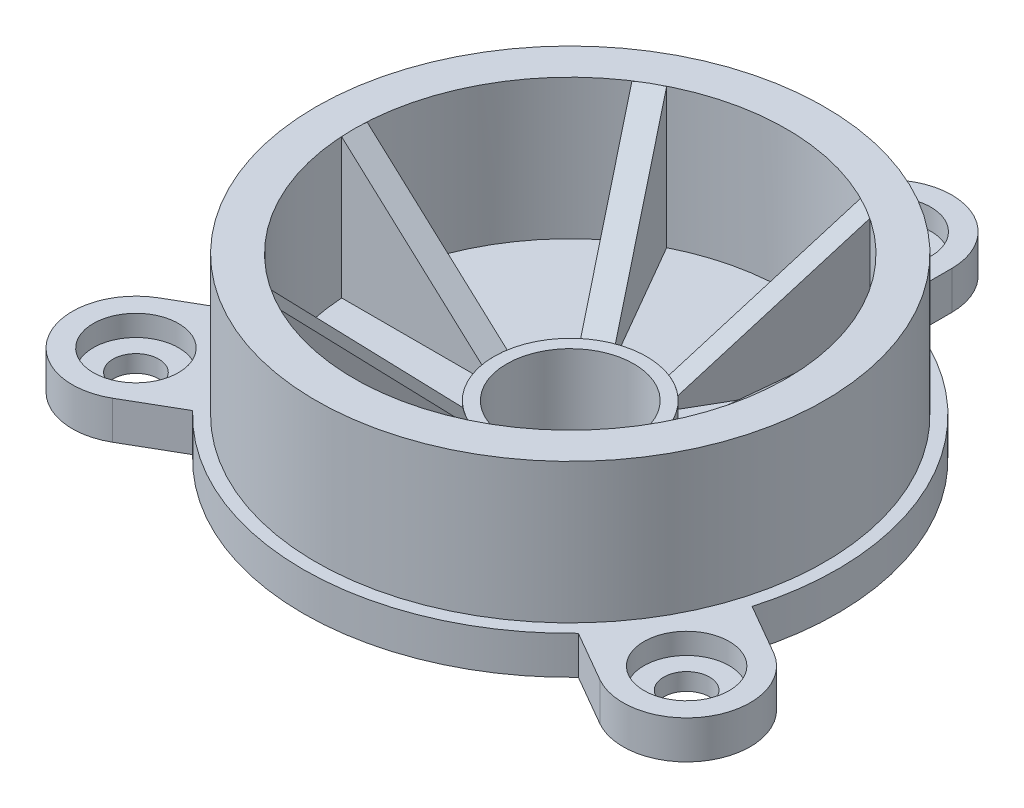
SolidWorks part; units mm, degrees
ref_plane "Front" through (0, 0, 0) normal (0, 0, 1) x (1, 0, 0)
ref_plane "Top" through (0, 0, 0) normal (0, 1, 0) x (1, 0, 0)
ref_plane "Right" through (0, 0, 0) normal (1, 0, 0) x (0, 0, -1)
sketch "Sketch1" plane through (0, 0, 0) normal (0, 0, 1) x (1, 0, 0)
  line L0 (0, 69.7565) -> (0, -46.2109) construction
  line L1 (17, 16) -> (20, 16)
  line L2 (20, 16) -> (20, 5)
  line L3 (20, 5) -> (21, 5)
  line L4 (21, 5) -> (21, 2)
  line L5 (21, 2) -> (10, 2)
  line L6 (10, 2) -> (10, 0)
  line L7 (10, 0) -> (5, 0)
  line L8 (6, 5) -> (6, 6)
  line L9 (17, 16) -> (17, 5)
  line L10 (17, 5) -> (6, 5)
  line L11 (6, 6) -> (5, 6)
  line L12 (5, 6) -> (5, 0)
  dimension "D1" = 42
  dimension "D2" = 40
  dimension "D3" = 20
  dimension "D4" = 34
  dimension "D5" = 2
  dimension "D6" = 3
  dimension "D7" = 11
  dimension "D8" = 12
  dimension "D9" = 10
  dimension "D10" = 1
revolve "Revolve1" add sketch "Sketch1" angle 360 about L0
sketch "Sketch2" plane through (0, 5, 0) normal (0, 1, 0) x (-1, 0, 0)
  line L0 (0, 0) -> (0, -28.3839) construction
  line L1 (5, -25) -> (5, -20.3961)
  line L2 (-5, -25) -> (-5, -20.3961)
  arc A0 (-5, -25) -> (5, -25) centre (0, -25) ccw
  circle A1 centre (0, 0) radius 21 construction
  arc A2 (-5, -20.3961) -> (5, -20.3961) centre (0, 0) ccw
  dimension "D2" = 5
  dimension "D1" = 25
extrude "Extrude1" add sketch "Sketch2" against normal up to surface (3 mm away)
hole_wizard "CBORE for M3 SBHCS1" positions "Sketch4" profile "Sketch3" counterbore size "M3" standard "Ansi Metric"
sketch "Sketch4" plane through (0, 5, 0) normal (0, 1, 0) x (-1, 0, 0)
  arc A0 (-5, -25) -> (5, -25) centre (0, -25) ccw construction
  point P0 (0, -25)
sketch "Sketch3" plane through (0, 5, -25) normal (1, 0, 0) x (0, 0, 1)
  line L0 (0, 0) -> (0, 5)
  line L1 (0, 5) -> (1.8, 5)
  line L3 (1.8, 5) -> (1.8, 1.65)
  line L4 (1.8, 1.65) -> (3.35, 1.65)
  line L5 (3.35, 1.65) -> (3.35, 0)
  line L7 (3.35, 0) -> (0, 0)
  line L11 (0, -6.35) -> (0, 107.95) construction
  dimension "Thru Hole Dia." = 3.6
  dimension "Thru Hole Depth" = 5
  dimension "C'Bore Dia." = 6.7
  dimension "C'Bore Depth" = 1.65
pattern_circular "CirPattern1" count 3 over 360 about axis through (0, 0, 0) along (0, 1, 0) of "Extrude1", "CBORE for M3 SBHCS1"
sketch "Sketch5" plane through (0, 0, 0) normal (0, 0, 1) x (1, 0, 0)
  line L0 (-17, 16) -> (-6, 6)
rib "Rib1" sketch "Sketch5" sketch "Sketch5" thickness 2 extrusion direction parallel to sketch draft on no parameters "D1"=2
pattern_circular "CirPattern2" count 6 over 360 about axis through (0, 0, 0) along (0, 1, 0) of "Rib1"
